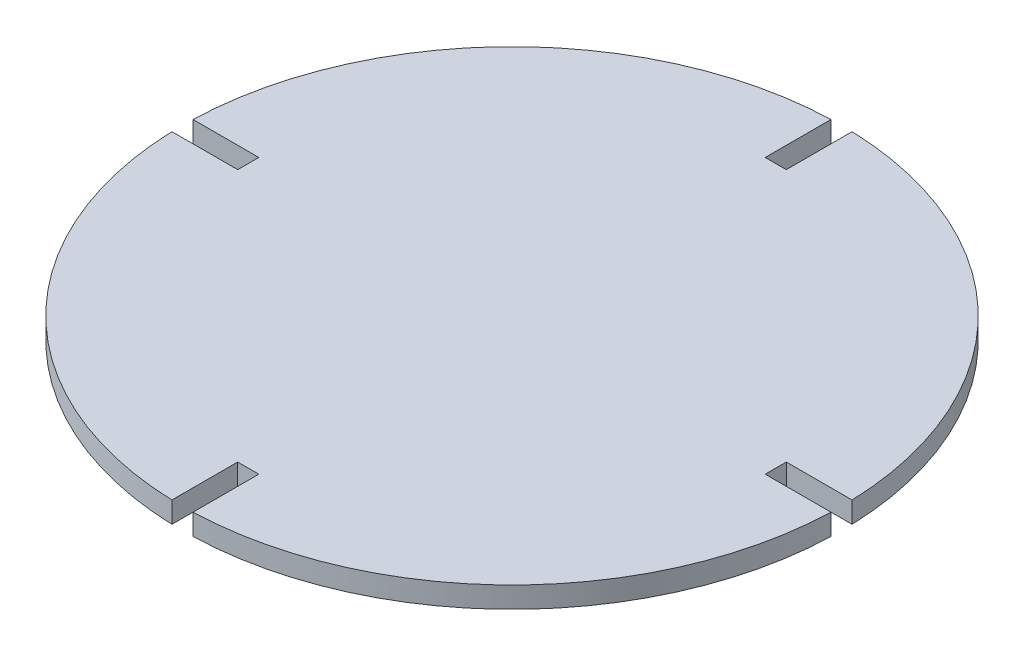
SolidWorks part; units mm, degrees
ref_plane "Front Plane" through (0, 0, 0) normal (0, 0, 1) x (1, 0, 0)
ref_plane "Top Plane" through (0, 0, 0) normal (0, 1, 0) x (1, 0, 0)
ref_plane "Right Plane" through (0, 0, 0) normal (1, 0, 0) x (0, 0, -1)
sketch "Sketch1" plane through (0, 0, 0) normal (0, 1, 0) x (1, 0, 0)
  line L0 (-716.4708, 0) -> (716.4708, 0) construction
  line L1 (0, 598.416) -> (0, -598.416) construction
  line L6 (-500, 16) -> (-400, 16)
  line L7 (-400, 16) -> (-400, -16)
  line L8 (-400, -16) -> (-500, -16)
  line L9 (-500, -16) -> (-500, 16)
  line L10 (16, 500) -> (16, 400)
  line L11 (-16, 400) -> (-16, 500)
  line L12 (16, 400) -> (-16, 400)
  line L13 (-16, 500) -> (16, 500)
  line L14 (500, -16) -> (400, -16)
  line L15 (400, 16) -> (500, 16)
  line L16 (400, -16) -> (400, 16)
  line L17 (500, 16) -> (500, -16)
  line L18 (-16, -500) -> (-16, -400)
  line L19 (16, -400) -> (16, -500)
  line L20 (-16, -400) -> (16, -400)
  line L21 (16, -500) -> (-16, -500)
  circle A0 centre (0, 0) radius 500
  point P9 (-400, 0)
  point P27 (0, 0)
  dimension "D1" = 1000
  dimension "D2" = 32
  dimension "D3" = 100
  dimension "D5" = 800
  dimension "D6" = 800
  dimension "D4" = 4
extrude "Boss-Extrude1" add sketch "Sketch1" along normal blind 32 contours L19 A0 L14 L16 L15 L10 L12 L11 L6 L7 L8 L18 L20
